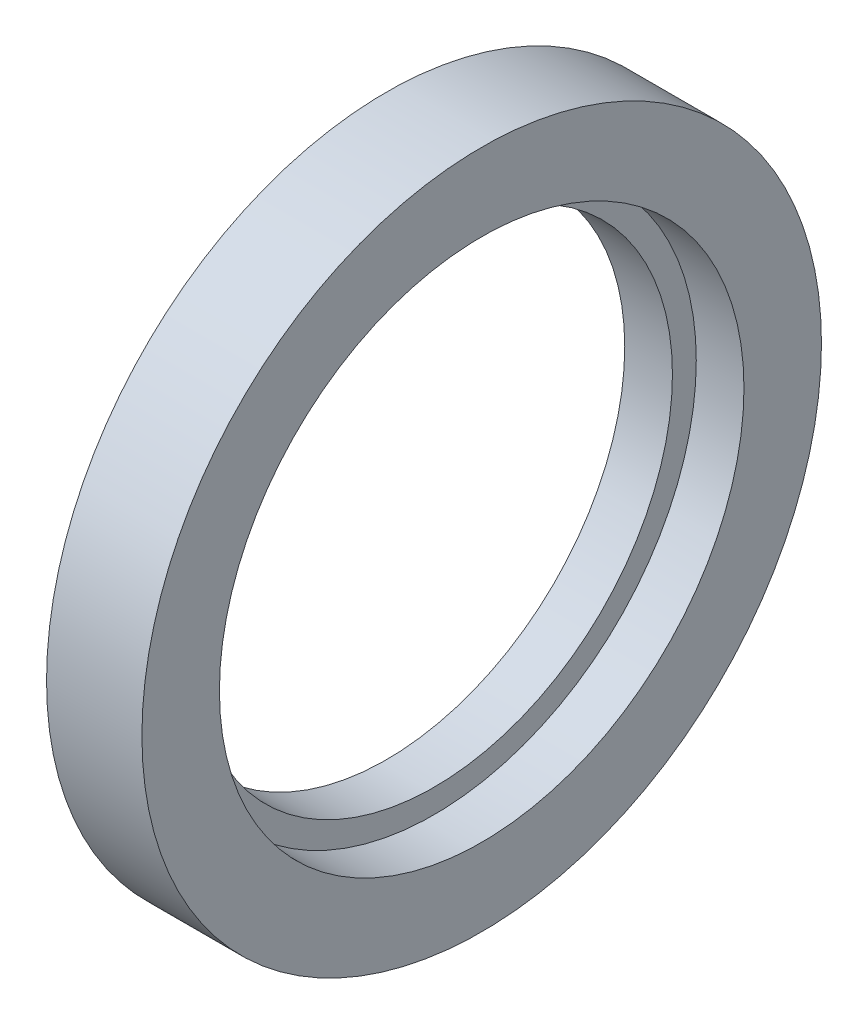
SolidWorks part; units mm, degrees
ref_plane "Front Plane" through (0, 0, 0) normal (0, 0, 1) x (1, 0, 0)
ref_plane "Top Plane" through (0, 0, 0) normal (0, 1, 0) x (1, 0, 0)
ref_plane "Right Plane" through (0, 0, 0) normal (1, 0, 0) x (0, 0, -1)
sketch "Sketch1" plane through (0, 0, 0) normal (1, 0, 0) x (0, 0, -1)
  circle A0 centre (0, 0) radius 71.25
  circle A1 centre (0, 0) radius 50
  dimension "D1" = 142.5
  dimension "D2" = 100
extrude "Boss-Extrude1" add sketch "Sketch1" along normal blind 20
sketch "Sketch2" plane through (20, 0, 0) normal (1, 0, 0) x (0, 0, -1)
  circle A0 centre (0, 0) radius 55
  dimension "D1" = 110
extrude "Cut-Extrude1" cut sketch "Sketch2" against normal blind 10
